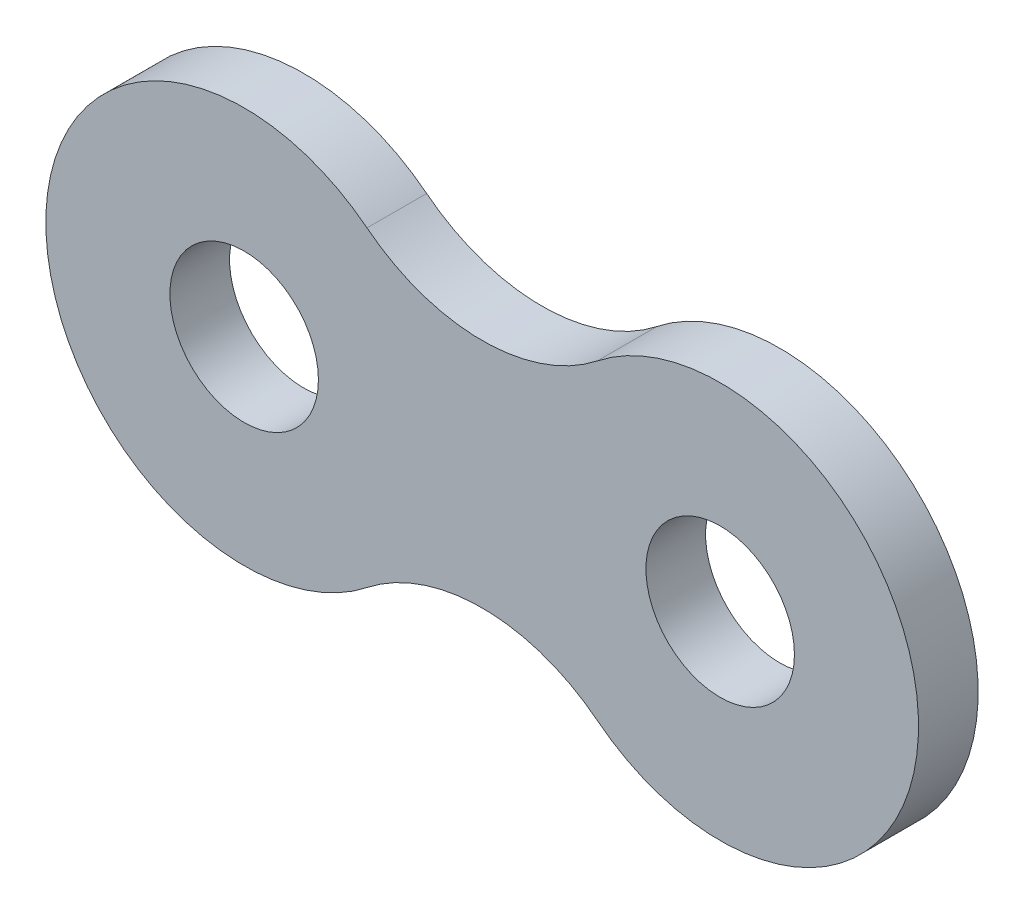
SolidWorks part; units mm, degrees
ref_plane "Front" through (0, 0, 0) normal (0, 0, 1) x (1, 0, 0)
ref_plane "Top" through (0, 0, 0) normal (0, 1, 0) x (1, 0, 0)
ref_plane "Right" through (0, 0, 0) normal (1, 0, 0) x (0, 0, -1)
sketch "Master Sketch" plane through (0, 0, 0) normal (0, 0, 1) x (1, 0, 0)
  circle A0 centre (0, 0) radius 2.9718
  circle A1 centre (0, 0) radius 4.464
  circle A2 centre (0, 0) radius 5.9563
sketch "Sketch3" plane through (0, 0, 0) normal (0, 0, 1) x (1, 0, 0)
  line L0 (0, 0) -> (19.05, 0) construction
  arc A1 (14.1342, -6.2321) -> (14.1342, 6.2321) centre (19.05, 0) ccw
  arc A2 (4.9158, 6.2321) -> (14.1342, 6.2321) centre (9.525, 12.0756) ccw
  arc A3 (4.9158, 6.2321) -> (4.9158, -6.2321) centre (0, 0) ccw
  arc A4 (4.9158, -6.2321) -> (14.1342, -6.2321) centre (9.525, -12.0756) cw
  circle A6 centre (0, 0) radius 2.9718
  circle A7 centre (19.05, 0) radius 2.9718
  dimension "D2" = 19.05
  dimension "D1" = 15.875
  dimension "D3" = 7.4425
  dimension "D4" = 5.9436
extrude "Base-Extrude" add sketch "Sketch3" along normal blind 2.3876
equation "\"Bushing Diameter@Master Sketch\" = \"Pin Diameter@Master Sketch\" +  (  ( \"Roller Diameter@Master Sketch\" - \"Pin Diameter@Master Sketch\" )  / 2 ) "
